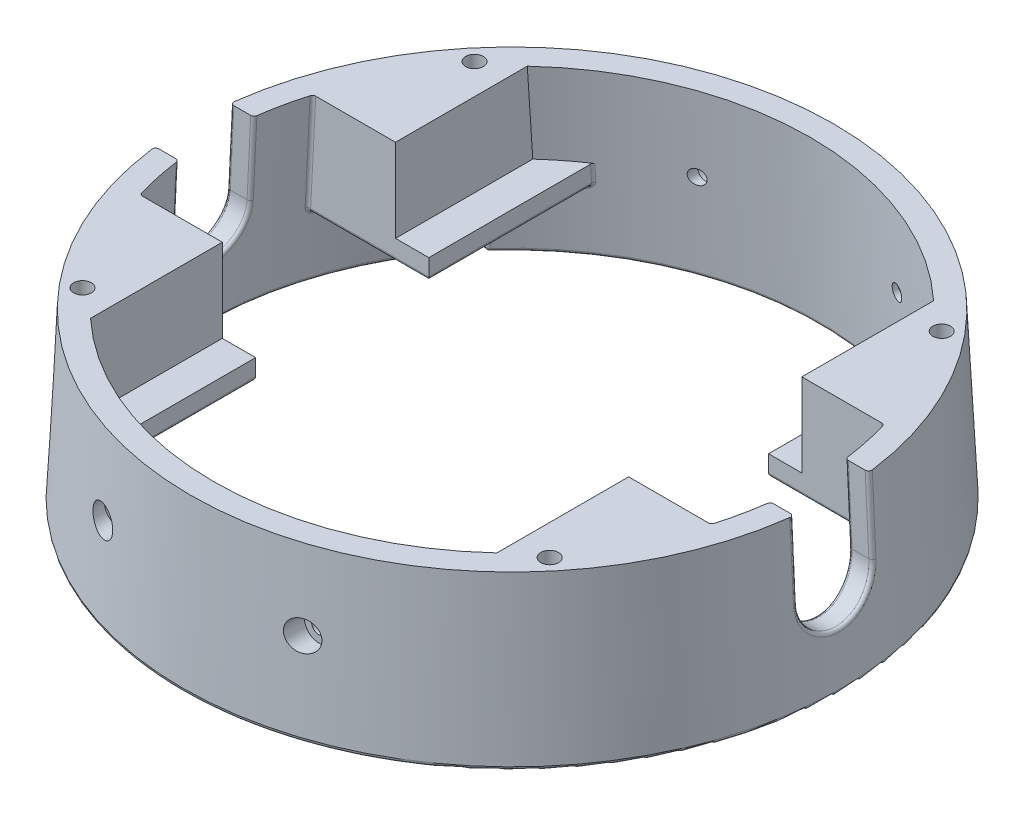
SolidWorks part; units mm, degrees
ref_plane "Front Plane" through (0, 0, 0) normal (0, 0, 1) x (1, 0, 0)
ref_plane "Top Plane" through (0, 0, 0) normal (0, 1, 0) x (1, 0, 0)
ref_plane "Right Plane" through (0, 0, 0) normal (1, 0, 0) x (0, 0, -1)
sketch "Sketch1" plane through (0, 0, 0) normal (0, 0, -1) x (-1, 0, 0)
  line L0 (-122.6312, 0) -> (-125.73, -63.5)
  line L1 (-125.73, -63.5) -> (-116.8294, -63.5)
  line L2 (-116.8294, -63.5) -> (-113.7306, 0)
  line L3 (-113.7306, 0) -> (-122.6312, 0)
  line L4 (0, 0) -> (0, -70.075) construction
  dimension "D1" = 245.2624
  dimension "D2" = 63.5
  dimension "D3" = 8.89
  dimension "D4" = 251.46
revolve "Revolve1" add sketch "Sketch1" angle 360 about L4
sketch "Sketch2" plane through (0, 0, 0) normal (1, 0, 0) x (0, 0, -1)
  line L0 (-14.2875, -28.575) -> (-14.2875, 0)
  line L1 (113.7306, 0) -> (-113.7306, 0) construction
  line L2 (-14.2875, 0) -> (14.2875, 0)
  line L3 (14.2875, 0) -> (14.2875, -28.575)
  line L4 (122.6312, 0) -> (-122.6312, 0) construction
  arc A0 (-14.2875, -28.575) -> (14.2875, -28.575) centre (0, -28.575) ccw
  dimension "D1" = 14.2875
  dimension "D2" = 28.575
extrude "Cut-Extrude1" cut sketch "Sketch2" against normal through all both and the other way through all
sketch "Sketch3" plane through (0, 0, 0) normal (0, 1, 0) x (1, 0, 0)
  line L0 (-118.102, -33.02) -> (-77.47, -33.02)
  line L1 (0, 0) -> (0, -139.2901) construction
  line L2 (-77.47, -33.02) -> (-77.47, -95.0621)
  line L3 (77.47, -33.02) -> (77.47, -95.0621)
  line L4 (77.47, -33.02) -> (118.102, -33.02)
  arc A1 (-118.102, -33.02) -> (-77.47, -95.0621) centre (0, 0) ccw
  arc A2 (-121.7961, -14.2875) -> (121.7961, -14.2875) centre (0, 0) ccw construction
  arc A4 (77.47, -95.0621) -> (118.102, -33.02) centre (0, 0) ccw
  dimension "D1" = 33.02
  dimension "D2" = 154.94
extrude "Boss-Extrude1" add sketch "Sketch3" against normal blind 6.35
sketch "Sketch4" plane through (0, 0, 33.02) normal (0, 0, -1) x (-1, 0, 0)
  line L0 (-83.82, -6.35) -> (-83.82, -39.37)
  line L2 (-83.82, -39.37) -> (-64.77, -39.37)
  line L3 (-64.77, -39.37) -> (-64.77, -31.75)
  line L4 (-64.77, -31.75) -> (-77.47, -31.75)
  line L5 (-77.47, -31.75) -> (-77.47, -6.35)
  line L6 (-77.47, -6.35) -> (-83.82, -6.35)
  line L7 (0, 0) -> (0, -42.2286) construction
  line L8 (77.47, -6.35) -> (83.82, -6.35)
  line L9 (77.47, -31.75) -> (77.47, -6.35)
  line L10 (64.77, -31.75) -> (77.47, -31.75)
  line L11 (64.77, -39.37) -> (64.77, -31.75)
  line L12 (83.82, -39.37) -> (64.77, -39.37)
  line L13 (83.82, -6.35) -> (83.82, -39.37)
  line L14 (77.47, -6.35) -> (109.1555, -6.35) construction
  line L15 (-77.47, -6.35) -> (-77.47, 0) construction
  dimension "D2" = 6.35
  dimension "D3" = 7.62
  dimension "D4" = 12.7
  dimension "D5" = 25.4
extrude "Boss-Extrude2" add sketch "Sketch4" against normal up to next
sketch "Sketch11" plane through (0, -39.37, 0) normal (0, -1, 0) x (1, 0, 0)
  line L0 (-83.82, 66.6518) -> (-95.9513, 66.6518)
  line L1 (-83.82, 77.3269) -> (-83.82, 33.02) construction
  line L2 (-83.82, 66.6518) -> (-83.82, 81.3838)
  line L3 (-83.82, 79.6842) -> (-83.82, 33.02) construction
  line L4 (0, 0) -> (0, 57.8307) construction
  line L5 (83.82, 66.6518) -> (83.82, 81.3838)
  line L6 (83.82, 66.6518) -> (95.9513, 66.6518)
  circle A0 centre (0, 0) radius 116.8294 construction
  arc A1 (-95.9513, 66.6518) -> (-83.82, 81.3838) centre (0, 0) cw
  arc A2 (95.9513, 66.6518) -> (83.82, 81.3838) centre (0, 0) ccw
  dimension "D1" = 14.732
extrude "Boss-Extrude4" add sketch "Sketch11" against normal up to surface (33.02 mm away)
fillet "Fillet1" radius 3.175 4 edges at (-83.82, -22.86, 66.6518) (83.82, -22.86, 66.6518)
sketch "Sketch8" plane through (0, 0, 33.02) normal (0, 0, -1) x (-1, 0, 0)
  line L0 (-83.82, 0) -> (-83.82, -39.37)
  line L1 (-83.82, -39.37) -> (-115.6519, -39.37)
  line L2 (-116.8294, -63.5) -> (-113.7306, 0) construction
  line L3 (-115.6519, -39.37) -> (-113.7306, 0)
  line L4 (-113.7306, 0) -> (-83.82, 0)
  line L5 (108.8317, 0) -> (77.47, 0) construction
  line L6 (-83.82, -39.37) -> (-64.77, -39.37) construction
  line L7 (-83.82, -6.35) -> (-83.82, -39.37) construction
  line L8 (0, 0) -> (0, -79.8686) construction
  line L9 (113.7306, 0) -> (83.82, 0)
  line L10 (115.6519, -39.37) -> (113.7306, 0)
  line L11 (83.82, -39.37) -> (115.6519, -39.37)
  line L12 (83.82, 0) -> (83.82, -39.37)
extrude "Boss-Extrude3" add sketch "Sketch8" against normal blind 6.35
ref_plane "Plane1" through (0, 0, 127) normal (0, 0, 1) x (1, 0, 0)
hole_wizard "CBORE for #10 Binding Head Machine Screw1" positions "Sketch12" profile "Sketch13" counterbore size "#10" standard "ANSI Inch"
sketch "Sketch12" plane through (0, 0, 127) normal (0, 0, 1) x (1, 0, 0)
  line L0 (0, 0) -> (0, -75.9111) construction
  circle A0 centre (-38.1, -29.6545) radius 3.5719 construction
  point P0 (-38.1, -29.6545)
  point P12 (38.1, -29.6545)
sketch "Sketch13" plane through (-38.1, -29.6545, 127) normal (1, 0, 0) x (0, -1, 0)
  line L0 (0, 0) -> (0, 52.4864)
  line L1 (0, 52.4864) -> (2.8067, 50.8)
  line L2 (2.8067, 50.8) -> (2.8067, 15.24)
  line L3 (2.8067, 15.24) -> (5.5562, 15.24)
  line L4 (5.5562, 15.24) -> (5.5562, 0)
  line L5 (5.5562, 0) -> (0, 0)
  line L10 (0, 52.4864) -> (-2.8067, 50.8) construction
  line L11 (0, -6.35) -> (0, 107.95) construction
  dimension "Hole Dia." = 5.6134
  dimension "Hole Depth" = 50.8
  dimension "C'Bore Dia." = 11.1125
  dimension "C'Bore Depth" = 15.24
  dimension "Drill Angle" = 118
mirror "Mirror3" about plane through (0, 0, 0) normal (0, 0, 1) of "CBORE for #10 Binding Head Machine Screw1", "Boss-Extrude3", "Boss-Extrude2", "Boss-Extrude1", "Boss-Extrude4", "Fillet1"
hole_wizard "17/64 (0.26563) Diameter Hole1" positions "Sketch9" profile "Sketch10" hole size "17/64" standard "ANSI Inch"
sketch "Sketch9" plane through (0, 0, 0) normal (0, 1, 0) x (1, 0, 0)
  point P0 (-89.0668, -74.736)
  point P3 (89.0668, -74.736)
  point P6 (89.0668, 74.736)
  point P9 (-89.0668, 74.736)
sketch "Sketch10" plane through (-89.0668, 0, 74.736) normal (1, 0, 0) x (0, 0, 1)
  line L0 (0, 0) -> (0, 63.5)
  line L1 (0, 63.5) -> (3.3735, 63.5)
  line L2 (3.3735, 63.5) -> (3.3735, 0)
  line L5 (3.3735, 0) -> (0, 0)
  line L11 (0, -6.35) -> (0, 107.95) construction
  dimension "Thru Hole Dia." = 6.747
  dimension "Thru Hole Depth" = 63.5
fillet "Fillet2" radius 1.27 101 edges at (87.0421, -56.7613, 77.4342) (91.3725, -56.7613, -72.2734) (115.8057, -42.766, 1.6579) (-115.8057, -42.766, -1.6579) (-124.7071, -42.7655, 1.6619) (124.7071, -42.7655, -1.6619) (93.137, -39.37, 68.5628) (93.9029, -39.37, 66.4723) (89.9219, -39.37, 66.6518) (84.7499, -39.37, 65.7219) (83.82, -39.37, 51.4234) (96.2822, -39.37, 39.37) (109.8371, -39.37, 36.2101) (87.8039, -39.37, 33.02) (64.77, -39.37, 64.4167) (76.1938, -39.37, 87.0049) (86.4826, -39.37, 72.5675) (64.77, -39.37, -64.4167) (109.8371, -39.37, -36.2101) (96.2822, -39.37, -39.37) (83.82, -39.37, -51.4234) (84.7499, -39.37, -65.7219) (89.9219, -39.37, -66.6518) (94.7341, -39.37, -66.0338) (93.137, -39.37, -68.5628) (86.4826, -39.37, -72.5675) (76.1938, -39.37, -87.0049) (0, -63.5, 125.73) (-116.8294, -63.5, 0) (-91.6511, -63.5, -76.9044) (0, -63.5, -116.8294) (91.6511, -63.5, -76.9044) (116.8294, -63.5, 0) (91.6511, -63.5, 76.9044) (0, -63.5, 116.8294) (-91.6511, -63.5, 76.9044) (-91.3725, -56.7613, 72.2734) (-87.0421, -56.7613, -77.4342) (-101.0985, -6.35, -52.7667) (-83.82, -6.35, -51.4234) (-84.7499, -6.35, -65.7219) (-88.9426, -6.35, -66.6518) (-92.7499, -6.35, -66.0525) (-84.7499, -6.35, 65.7219) (-83.82, -6.35, 51.4234) (-101.0985, -6.35, 52.7667) (-91.9444, -6.35, 66.4723) (-88.9426, -6.35, 66.6518) (-76.1938, -39.37, 87.0049) (-64.77, -39.37, 64.4167) (-83.82, -39.37, 51.4234) (-84.7499, -39.37, 65.7219) (-89.9219, -39.37, 66.6518) (-94.7341, -39.37, 66.0339) (-93.137, -39.37, 68.5628) (-86.4826, -39.37, 72.5675) (-93.903, -39.37, -66.4723) (-89.9219, -39.37, -66.6518) (-84.7499, -39.37, -65.7219) (-83.82, -39.37, -51.4234) (-87.8039, -39.37, -33.02) (-64.77, -39.37, -64.4167) (-76.1938, -39.37, -87.0049) (-86.4826, -39.37, -72.5675) (-93.137, -39.37, -68.5628) (-95.4246, -6.35, -39.37) (-95.4246, -6.35, 39.37) (-109.8371, -39.37, 36.2101) (-96.2822, -39.37, 39.37) (-96.2822, -39.37, -39.37) (-109.8371, -39.37, -36.2101) (83.82, -22.86, -39.37) (-83.82, -22.86, -39.37) (-83.82, -22.86, 39.37) (83.82, -22.86, 39.37) (-87.8039, -39.37, 33.02) (87.8039, -39.37, -33.02)
